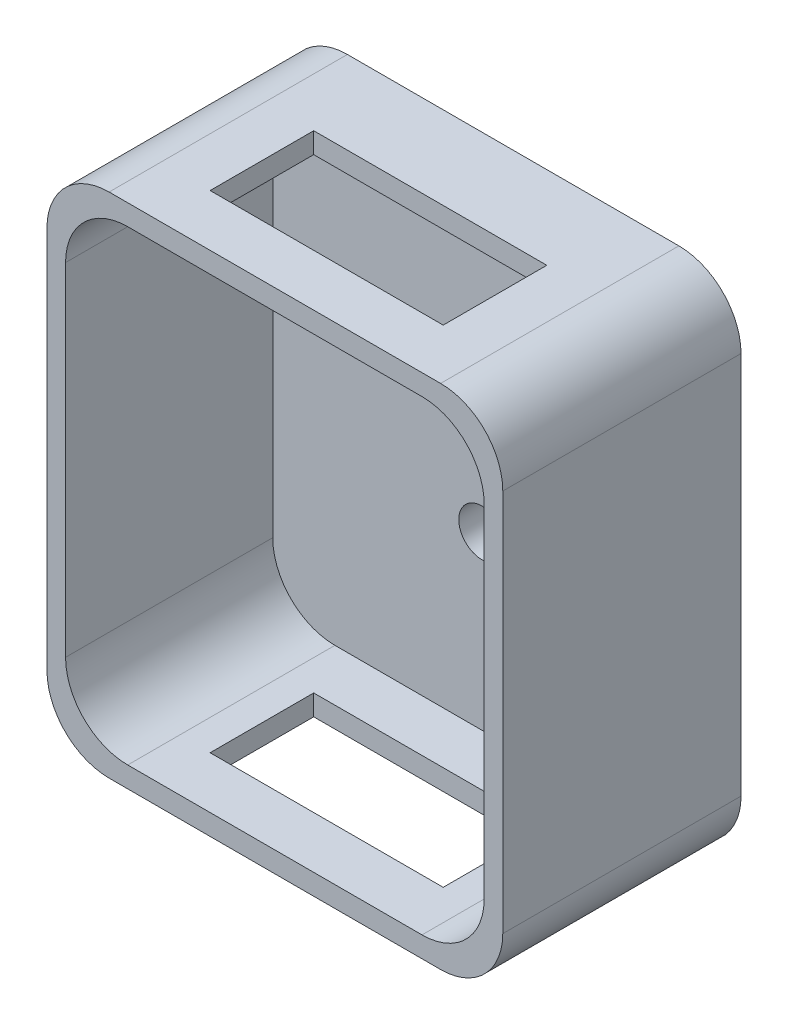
SolidWorks part; units mm, degrees
ref_plane "Plan de face" through (0, 0, 0) normal (0, 0, 1) x (1, 0, 0)
ref_plane "Plan de dessus" through (0, 0, 0) normal (0, 1, 0) x (1, 0, 0)
ref_plane "Plan de droite" through (0, 0, 0) normal (1, 0, 0) x (0, 0, -1)
sketch "Esquisse1" plane through (0, 0, 0) normal (0, 0, 1) x (1, 0, 0)
  line L0 (-18, -20) -> (18, -20) construction
  line L1 (-18, -20) -> (-18, 20) construction
  line L2 (-18, 20) -> (18, 20) construction
  line L3 (18, -20) -> (18, 20) construction
  line L4 (-18, -20) -> (18, 20) construction
  line L5 (-18, 20) -> (18, -20) construction
  line L6 (-16, -24.5) -> (16, -24.5)
  line L7 (-22, -18.5) -> (-22, 18.5)
  line L8 (-16, 24.5) -> (16, 24.5)
  line L9 (22, -18.5) -> (22, 18.5)
  line L10 (-22, -24.5) -> (22, 24.5) construction
  line L11 (-22, 24.5) -> (22, -24.5) construction
  line L16 (-20.2041, 22.5) -> (20.2041, -22.5) construction
  line L17 (-20.2041, -22.5) -> (20.2041, 22.5) construction
  line L18 (0, 29.6721) -> (0, -43.8886) construction
  line L19 (-17.25, 18.5) -> (17.25, 18.5) construction
  line L20 (-17.25, 18.5) -> (-17.25, -18.5) construction
  line L21 (-17.25, -18.5) -> (17.25, -18.5) construction
  line L22 (17.25, 18.5) -> (17.25, -18.5) construction
  line L23 (-17.25, 18.5) -> (17.25, -18.5) construction
  line L24 (-17.25, -18.5) -> (17.25, 18.5) construction
  line L25 (-32.0282, 0) -> (30.9458, 0) construction
  arc A0 (-22, -18.5) -> (-16, -24.5) centre (-16, -18.5) ccw
  arc A1 (16, -24.5) -> (22, -18.5) centre (16, -18.5) ccw
  arc A2 (22, 18.5) -> (16, 24.5) centre (16, 18.5) ccw
  arc A3 (-16, 24.5) -> (-22, 18.5) centre (-16, 18.5) ccw
  circle A4 centre (13.4, 12.275) radius 1.5
  circle A5 centre (13.4, -8.225) radius 1.5
  circle A6 centre (0, 6) radius 2.25
  circle A7 centre (0, -6) radius 2.25
  point P0 (0, 0)
  point P5 (0, 0)
  point P22 (0, 0)
  point P27 (0, 0)
  dimension "D5" = 4.5
  dimension "D7" = 34.5
  dimension "D8" = 0
  dimension "D6" = 37
  dimension "D9" = 3
  dimension "D10" = 3.85
  dimension "D11" = 3
  dimension "D12" = 20.5
  dimension "D15" = 0
  dimension "D4" = 6
  dimension "D13" = 6.225
  dimension "D14" = 13.4
  dimension "D18" = 12
  dimension "D19" = 4.5
  dimension "D20" = 4.5
  dimension "D21" = 6
  dimension "D1" = 36
  dimension "D2" = 40
  dimension "D3" = 4
  dimension "D16" = 62.974
  dimension "D17" = 90
extrude "Boss.-Extru.1" add sketch "Esquisse1" along normal blind 3
ref_plane "Plan1" through (0, 0, 3) normal (0, 0, 1) x (1, 0, 0)
sketch "Esquisse2" plane through (0, 0, 3) normal (0, 0, 1) x (1, 0, 0)
  line L0 (-18, -20) -> (18, -20) construction
  line L1 (-18, -20) -> (-18, 20) construction
  line L2 (-18, 20) -> (18, 20) construction
  line L3 (18, -20) -> (18, 20) construction
  line L4 (-18, -20) -> (18, 20) construction
  line L5 (-18, 20) -> (18, -20) construction
  line L6 (-16, -24.5) -> (16, -24.5)
  line L7 (-22, -18.5) -> (-22, 18.5)
  line L8 (-16, 24.5) -> (16, 24.5)
  line L9 (22, -18.5) -> (22, 18.5)
  line L10 (-22, -24.5) -> (22, 24.5) construction
  line L11 (-22, 24.5) -> (22, -24.5) construction
  line L12 (-14.2041, 22.5) -> (14.2041, 22.5)
  line L13 (-20.2041, 16.5) -> (-20.2041, -16.5)
  line L14 (-14.2041, -22.5) -> (14.2041, -22.5)
  line L15 (20.2041, 16.5) -> (20.2041, -16.5)
  line L16 (-20.2041, 22.5) -> (20.2041, -22.5) construction
  line L17 (-20.2041, -22.5) -> (20.2041, 22.5) construction
  arc A0 (-22, -18.5) -> (-16, -24.5) centre (-16, -18.5) ccw
  arc A1 (16, -24.5) -> (22, -18.5) centre (16, -18.5) ccw
  arc A2 (22, 18.5) -> (16, 24.5) centre (16, 18.5) ccw
  arc A3 (-16, 24.5) -> (-22, 18.5) centre (-16, 18.5) ccw
  arc A4 (-20.2041, -16.5) -> (-14.2041, -22.5) centre (-14.2041, -16.5) ccw
  arc A5 (14.2041, -22.5) -> (20.2041, -16.5) centre (14.2041, -16.5) ccw
  arc A6 (20.2041, 16.5) -> (14.2041, 22.5) centre (14.2041, 16.5) ccw
  arc A7 (-20.2041, 16.5) -> (-14.2041, 22.5) centre (-14.2041, 16.5) cw
  point P0 (0, 0)
  point P5 (0, 0)
  point P22 (0, 0)
  dimension "D5" = 6
  dimension "D7" = 6
  dimension "D8" = 6
  dimension "D1" = 36
  dimension "D2" = 40
  dimension "D3" = 20.2041
  dimension "D4" = 4
  dimension "D6" = 2
  dimension "D9" = 0
extrude "Boss.-Extru.2" add sketch "Esquisse2" along normal blind 20
ref_plane "Plan2" through (0, 24.5, 0) normal (0, 1, 0) x (1, 0, 0)
sketch "Esquisse3" plane through (0, 24.5, 0) normal (0, 1, 0) x (1, 0, 0)
  line L0 (16, 0) -> (-16, 0) construction
  line L3 (-11.25, -8) -> (11.25, -8)
  line L5 (-11.25, -8) -> (-11.25, -18)
  line L6 (11.25, -8) -> (11.25, -18)
  line L7 (-11.25, -18) -> (11.25, -18)
  dimension "D1" = 8
  dimension "D2" = 10
  dimension "D3" = 11.25
  dimension "D4" = 11.25
extrude "Enlèv. mat.-Extru.1" cut sketch "Esquisse3" against normal blind 54
